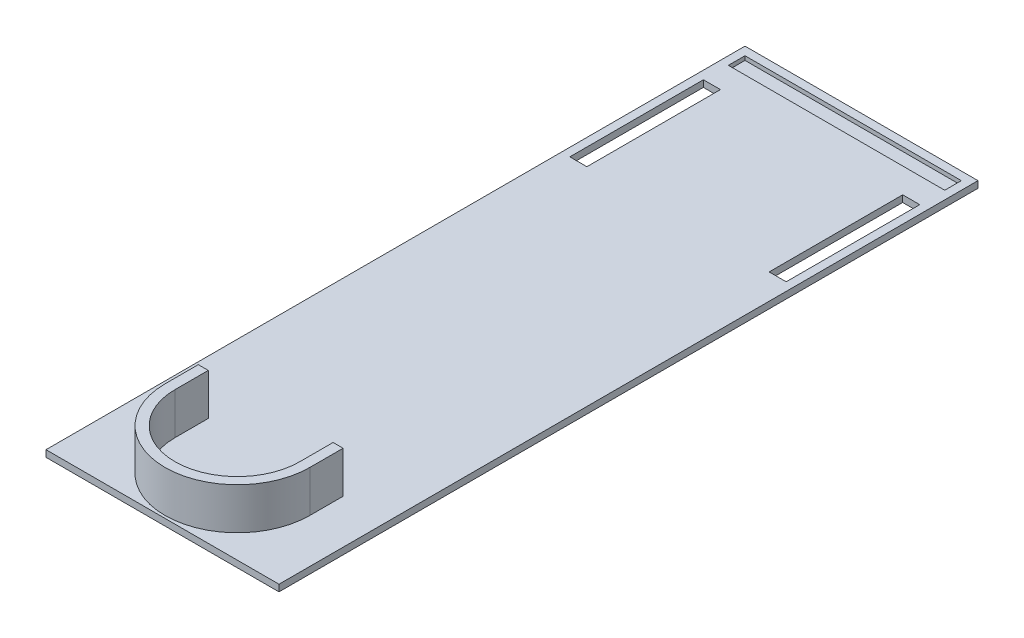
SolidWorks part; units mm, degrees
ref_plane "Front Plane" through (0, 0, 0) normal (0, 0, 1) x (1, 0, 0)
ref_plane "Top Plane" through (0, 0, 0) normal (0, 1, 0) x (1, 0, 0)
ref_plane "Right Plane" through (0, 0, 0) normal (1, 0, 0) x (0, 0, -1)
sketch "Sketch2" plane through (0, 0, 0) normal (0, 1, 0) x (1, 0, 0)
  line L0 (-70, 70) -> (70, 70) construction
  line L1 (-70, 210) -> (70, 210)
  line L2 (-70, 210) -> (-70, -210)
  line L3 (-70, -210) -> (70, -210)
  line L4 (70, 210) -> (70, -210)
  line L5 (-70, 210) -> (70, -210) construction
  line L6 (-70, -210) -> (70, 210) construction
  point P0 (0, 0)
  dimension "D1" = 420
  dimension "D2" = 140
  dimension "D3" = 280
extrude "Boss-Extrude1" add sketch "Sketch2" along normal blind 4
sketch "Sketch3" plane through (0, 4, 0) normal (0, 1, 0) x (1, 0, 0)
  line L0 (0, 0) -> (0, -210) construction
  line L1 (-37.5, -165) -> (-37.5, -145)
  line L2 (-37.5, -145) -> (-43.5, -145)
  line L3 (-43.5, -145) -> (-43.5, -165)
  line L4 (70, -210) -> (70, 210)
  line L5 (70, 210) -> (-70, 210)
  line L6 (-70, 210) -> (-70, -210)
  line L7 (-70, -210) -> (70, -210)
  line L8 (70, -210) -> (70, 210)
  line L9 (70, 210) -> (-70, 210)
  line L10 (-70, 210) -> (-70, -210)
  line L11 (-70, -210) -> (70, -210)
  line L12 (37.5, -165) -> (37.5, -145)
  line L13 (37.5, -145) -> (43.5, -145)
  line L14 (43.5, -145) -> (43.5, -165)
  line L15 (-37.5, -165) -> (37.5, -165) construction
  arc A0 (-37.5, -165) -> (37.5, -165) centre (0, -165) ccw
  arc A1 (-43.5, -165) -> (43.5, -165) centre (0, -165) ccw
  dimension "D2" = 37.5
  dimension "D3" = 6
  dimension "D4" = 6
  dimension "D5" = 45
  dimension "D6" = 6
  dimension "D7" = 20
  dimension "D8" = 20
  dimension "D1" = 0
extrude "Boss-Extrude2" add sketch "Sketch3" along normal blind 25 contours L3 A1 L14 L13 L12 A0 L1 L2
sketch "Sketch4" plane through (0, 4, 0) normal (0, 1, 0) x (1, 0, 0)
  line L1 (-65, 180) -> (-54.75, 180)
  line L2 (-65, 180) -> (-65, 99.75)
  line L3 (-65, 99.75) -> (-54.75, 99.75)
  line L4 (-54.75, 180) -> (-54.75, 99.75)
  line L5 (-65, 180) -> (-54.75, 99.75) construction
  line L6 (-65, 99.75) -> (-54.75, 180) construction
  line L7 (54.75, 180) -> (65, 180)
  line L8 (54.75, 180) -> (54.75, 99.75)
  line L9 (54.75, 99.75) -> (65, 99.75)
  line L10 (65, 180) -> (65, 99.75)
  line L11 (54.75, 180) -> (65, 99.75) construction
  line L12 (54.75, 99.75) -> (65, 180) construction
  line L13 (-70, 210) -> (70, 210) construction
  line L14 (-70, 210) -> (-70, -210) construction
  line L15 (70, 210) -> (70, -210) construction
  point P4 (-59.875, 139.875)
  point P9 (59.875, 139.875)
  dimension "D1" = 10.25
  dimension "D2" = 10.25
  dimension "D3" = 80.25
  dimension "D4" = 80.25
  dimension "D5" = 30
  dimension "D6" = 30
  dimension "D7" = 5
  dimension "D8" = 5
extrude "Cut-Extrude1" cut sketch "Sketch4" against normal blind 25.4
sketch "Sketch6" plane through (0, 4, 0) normal (0, 1, 0) x (1, 0, 0)
  line L0 (-65, 99.75) -> (-54.75, 99.75) construction
  line L1 (-65, 99.75) -> (-54.75, 99.75)
  line L2 (0, -202.5) -> (0, 99.75) construction
  line L3 (0, 99.75) -> (-54.75, 99.75) construction
  arc A0 (-37.5, -165) -> (37.5, -165) centre (0, -165) ccw construction
  arc A1 (-37.5, -165) -> (37.5, -165) centre (0, -165) ccw
  point P5 (0, -202.5)
  dimension "D1" = 302.25
sketch "Sketch7" plane through (0, 4, 0) normal (0, 1, 0) x (1, 0, 0)
  line L0 (70, 210) -> (-70, 210) construction
  line L1 (-65, 205) -> (65, 205)
  line L2 (-65, 205) -> (-65, 195)
  line L3 (-65, 195) -> (65, 195)
  line L4 (65, 205) -> (65, 195)
  line L5 (-65, 205) -> (65, 195) construction
  line L6 (-65, 195) -> (65, 205) construction
  line L7 (-70, 210) -> (-70, -210) construction
  line L8 (70, -210) -> (70, 210) construction
  point P4 (0, 200)
  dimension "D1" = 5
  dimension "D2" = 5
  dimension "D3" = 5
  dimension "D4" = 10
extrude "Cut-Extrude2" cut sketch "Sketch7" against normal blind 2.45 contours L3 L4 L1 L2
